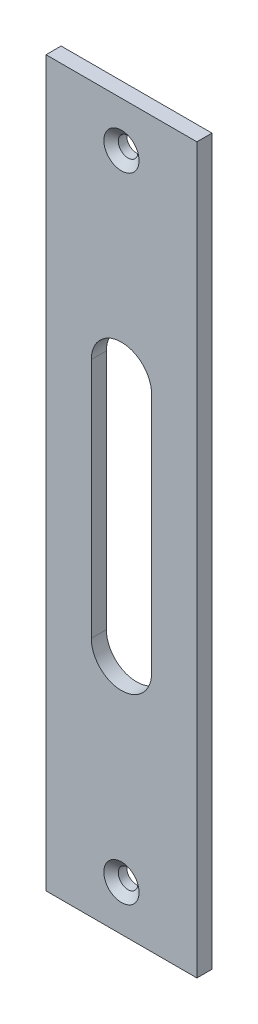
SolidWorks part; units mm, degrees
ref_plane "Front" through (0, 0, 0) normal (0, 0, 1) x (1, 0, 0)
ref_plane "Top" through (0, 0, 0) normal (0, 1, 0) x (1, 0, 0)
ref_plane "Right" through (0, 0, 0) normal (1, 0, 0) x (0, 0, -1)
sketch "Sketch1" plane through (0, 0, 0) normal (0, 0, 1) x (1, 0, 0)
  line L0 (7.9375, -12.813) -> (7.9375, -38.1) construction
  line L1 (-7.9375, -38.1) -> (-7.9375, -12.813) construction
  line L2 (-7.9375, -38.1) -> (7.9375, -38.1) construction
  line L3 (7.9375, 38.1) -> (7.9375, -38.1)
  line L4 (-7.9375, -38.1) -> (-7.9375, 38.1)
  line L5 (-7.9375, -38.1) -> (7.9375, -38.1)
  line L6 (7.9375, 38.1) -> (-7.9375, 38.1) construction
  line L7 (7.9375, 38.1) -> (-7.9375, 38.1)
extrude "Base-Extrude" add sketch "Sketch1" along normal up to surface (1.5875 mm away)
sketch "Sketch2" plane through (0, 0, 1.5875) normal (0, 0, 1) x (1, 0, 0)
  line L0 (3.175, 12.7) -> (3.175, -12.7)
  line L1 (-3.175, -12.7) -> (-3.175, 12.7)
  line L2 (0, 12.7) -> (0, -12.7) construction
  arc A0 (3.175, -12.7) -> (-3.175, -12.7) centre (0, -12.7) cw
  arc A1 (-3.175, 12.7) -> (3.175, 12.7) centre (0, 12.7) cw
  dimension "D2" = 25.4
  dimension "D1" = 6.35
extrude "Cut-Extrude1" cut sketch "Sketch2" against normal through all
hole_wizard "CSK for #1 Flat Head Machine Screw (100)1" positions "Sketch4" profile "Sketch3" countersink size "#1" standard "Ansi Inch"
sketch "Sketch4" plane through (0, 0, 1.5875) normal (0, 0, 1) x (1, 0, 0)
  circle A0 centre (0, -33.3375) radius 0.9271 construction
  point P0 (0, -33.3375)
  point P3 (0, 33.3375)
sketch "Sketch3" plane through (0, -33.3375, 1.5875) normal (1, 0, 0) x (0, -1, 0)
  line L0 (0, 0) -> (0, 1.5875)
  line L1 (0, 1.5875) -> (1.0287, 1.5875)
  line L2 (1.0287, 1.5875) -> (1.0287, 0.6927)
  line L3 (1.0287, 0.6927) -> (1.8542, 0)
  line L5 (1.8542, 0) -> (0, 0)
  line L6 (-1.0287, 0.6927) -> (-1.8542, 0) construction
  line L11 (0, -6.35) -> (0, 107.95) construction
  dimension "Thru Hole Dia." = 2.0574
  dimension "Thru Hole Depth" = 1.5875
  dimension "Near C'Sink Dia." = 3.7084
  dimension "Near C'Sink Angle" = 100
